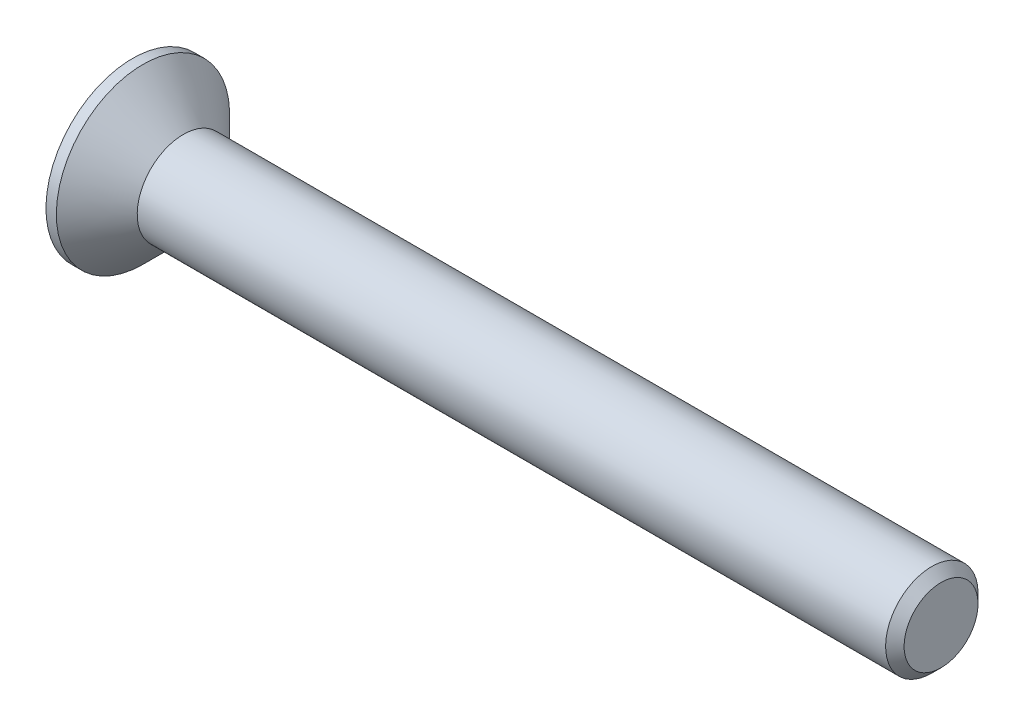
SolidWorks part; units mm, degrees
ref_plane "Front Plane" through (0, 0, 0) normal (0, 0, 1) x (1, 0, 0)
ref_plane "Top Plane" through (0, 0, 0) normal (0, 1, 0) x (1, 0, 0)
ref_plane "Right Plane" through (0, 0, 0) normal (1, 0, 0) x (0, 0, -1)
sketch "Sketch1" plane through (0, 0, 0) normal (0, 0, 1) x (1, 0, 0)
  line L1 (-2.2, 3.75) -> (-2.2, 0)
  line L2 (-2.2, 0) -> (32.8, 0)
  line L3 (32.8, 0) -> (32.8, 2)
  line L4 (32.8, 2) -> (0, 2)
  line L5 (-2.2, 3.75) -> (-1.75, 3.75)
  line L6 (-1.75, 3.75) -> (0, 2)
  dimension "D1" = 2
  dimension "D2" = 45
  dimension "D3" = 2.2
  dimension "D4" = 35
  dimension "D5" = 3.75
revolve "Revolve1" add sketch "Sketch1" angle 360 about L2
chamfer "Chamfer1" distance 0.4 angle 45 1 edges at (32.8, -2, 0)
sketch "Sketch2" plane through (-2.2, 0, 0) normal (-1, 0, 0) x (0, 0, 1)
  line L0 (-0.55, 2.2) -> (0.55, 2.2)
  line L1 (0.55, 2.2) -> (0.55, 0.55)
  line L2 (0.55, 0.55) -> (2.2, 0.55)
  line L3 (2.2, 0.55) -> (2.2, -0.55)
  line L4 (2.2, -0.55) -> (0.55, -0.55)
  line L5 (0.55, -0.55) -> (0.55, -2.2)
  line L6 (0.55, -2.2) -> (-0.55, -2.2)
  line L7 (-0.55, -2.2) -> (-0.55, -0.55)
  line L8 (-0.55, -0.55) -> (-2.2, -0.55)
  line L9 (-2.2, -0.55) -> (-2.2, 0.55)
  line L10 (-2.2, 0.55) -> (-0.55, 0.55)
  line L11 (-0.55, 0.55) -> (-0.55, 2.2)
  point P2 (0, 2.2)
  point P14 (0, -2.2)
  point P15 (2.2, 0)
  point P16 (-2.2, 0)
  dimension "D1" = 4.4
  dimension "D2" = 1.1
extrude "Cut-Extrude1" cut sketch "Sketch2" against normal blind 1.9
